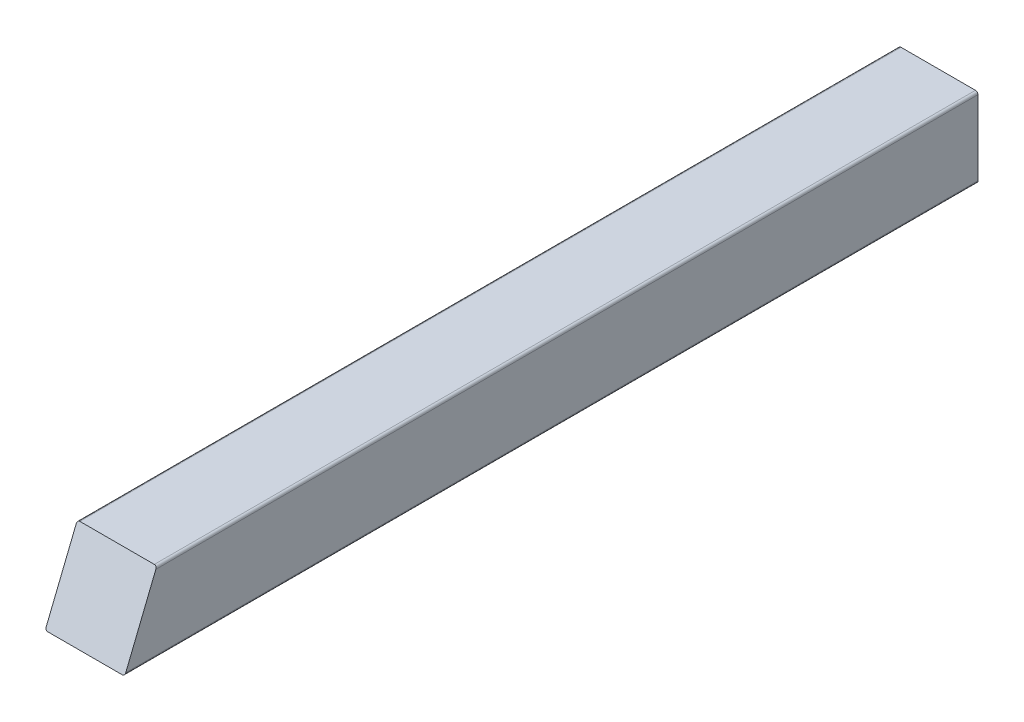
SolidWorks part; units mm, degrees
ref_plane "Front Plane" through (0, 0, 0) normal (0, 0, 1) x (1, 0, 0)
ref_plane "Top Plane" through (0, 0, 0) normal (0, 1, 0) x (1, 0, 0)
ref_plane "Right Plane" through (0, 0, 0) normal (1, 0, 0) x (0, 0, -1)
sketch "Sketch1" plane through (0, 0, 0) normal (0, 0, 1) x (1, 0, 0)
  line L0 (47.5, 47.5) -> (-47.5, 47.5) construction
  line L1 (-47.5, -47.5) -> (-47.5, 47.5) construction
  line L2 (47.5, -47.5) -> (-47.5, -47.5) construction
  line L3 (47.5, -47.5) -> (47.5, 47.5) construction
  line L4 (47.5, 47.5) -> (-47.5, 47.5)
  line L5 (-47.5, -47.5) -> (-47.5, 47.5)
  line L6 (47.5, -47.5) -> (-47.5, -47.5)
  line L7 (47.5, -47.5) -> (47.5, 47.5)
extrude "Extrude höjd" add sketch "Sketch1" along normal up to surface
fillet "Fillet kanter" radius 3 4 edges at (47.5, 47.5, 490.4044) (-47.5, 47.5, 490.4044) (-47.5, -47.5, 509.5956) (47.5, -47.5, 509.5956)
